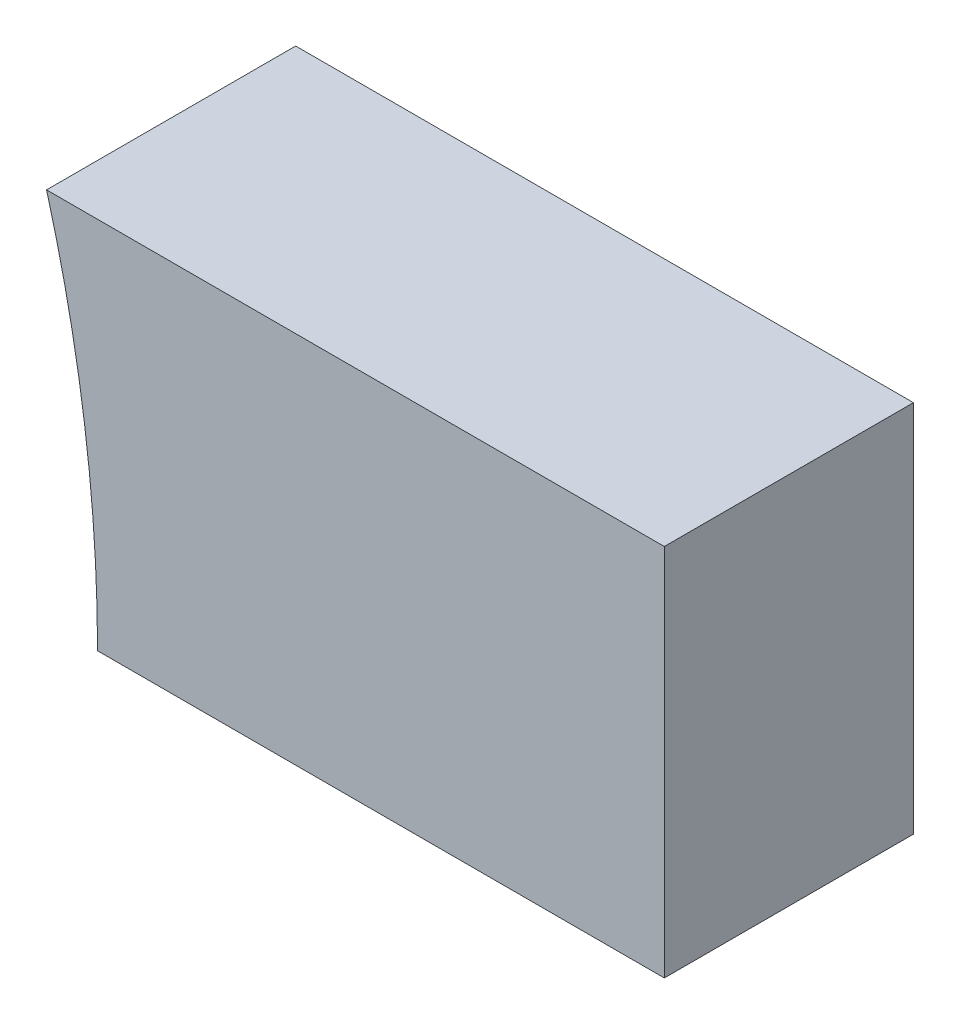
SolidWorks part; units mm, degrees
ref_plane "Plan de face" through (0, 0, 0) normal (0, 0, 1) x (1, 0, 0)
ref_plane "Plan de dessus" through (0, 0, 0) normal (0, 1, 0) x (1, 0, 0)
ref_plane "Plan de droite" through (0, 0, 0) normal (1, 0, 0) x (0, 0, -1)
sketch "Esquisse1" plane through (0, 0, 0) normal (0, 0, 1) x (1, 0, 0)
  line L0 (0, 0) -> (470.6608, 0) construction
  line L1 (0, -55.3377) -> (0, 353.7921) construction
  line L2 (0, 0) -> (442.2765, 160.9755) construction
  line L3 (0, 0) -> (360.5471, 302.5349) construction
  line L4 (0, 0) -> (235.3304, 407.6042) construction
  line L5 (0, 0) -> (81.7294, 463.5104) construction
  line L6 (0, 0) -> (-81.7294, 463.5104) construction
  line L7 (0, 0) -> (-235.3304, 407.6042) construction
  line L8 (0, 0) -> (-360.5471, 302.5349) construction
  line L9 (0, 0) -> (-442.2765, 160.9755) construction
  line L10 (0, 0) -> (-470.6608, 0) construction
  line L11 (-390.3547, -30) -> (366.2536, -30) construction
  line L12 (-390.3547, 30) -> (366.2536, 30) construction
  line L13 (-390.3547, 60) -> (366.2536, 60) construction
  line L14 (22.5, -55.3377) -> (22.5, 160.9755) construction
  line L15 (366.2536, 90) -> (-390.3547, 90) construction
  line L16 (45, -55.3377) -> (45, 160.9755) construction
  line L17 (-390.3547, 120) -> (366.2536, 120) construction
  line L18 (-90, -59.8279) -> (-90, 0) construction
  line L19 (366.2536, 150) -> (-390.3547, 150) construction
  line L20 (67.5, -55.3377) -> (67.5, 160.9755) construction
  line L21 (90, -55.3377) -> (90, 160.9755) construction
  line L22 (112.5, -55.3377) -> (112.5, 160.9755) construction
  line L23 (135, -55.3377) -> (135, 160.9755) construction
  line L24 (157.5, -55.3377) -> (157.5, 160.9755) construction
  line L25 (180, -55.3377) -> (180, 160.9755) construction
  line L26 (202.5, -55.3377) -> (202.5, 160.9755) construction
  line L27 (225, -55.3377) -> (225, 160.9755) construction
  line L28 (107.9074, 30) -> (157.5, 30)
  line L29 (157.5, 30) -> (157.5, 0)
  line L30 (157.5, 0) -> (112, 0)
  arc A0 (90, 0) -> (-90, 0) centre (0, 0) ccw construction
  arc A1 (112, 0) -> (-112, 0) centre (0, 0) ccw construction
  arc A2 (112, 0) -> (107.9074, 30) centre (0, 0) ccw
extrude "Extrusion1" add sketch "Esquisse1" along normal blind 20
